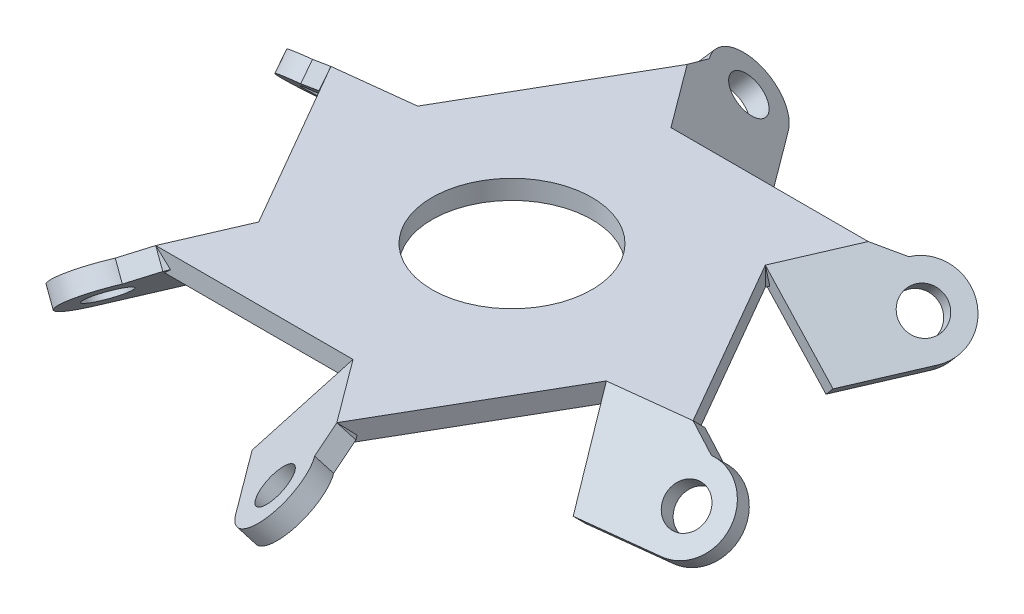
SolidWorks part; units mm, degrees
other "<MirrorMecanumHub - (Top)>-<<MecanumHub - (Top)>-<Imported1>>"
ref_plane "Front Plane" through (0, 0, 0) normal (0, 0, 1) x (1, 0, 0)
ref_plane "Top Plane" through (0, 0, 0) normal (0, 1, 0) x (1, 0, 0)
ref_plane "Right Plane" through (0, 0, 0) normal (1, 0, 0) x (0, 0, -1)
mirrored part "MirrorMecanumHub - (Top)_Mirrored"
